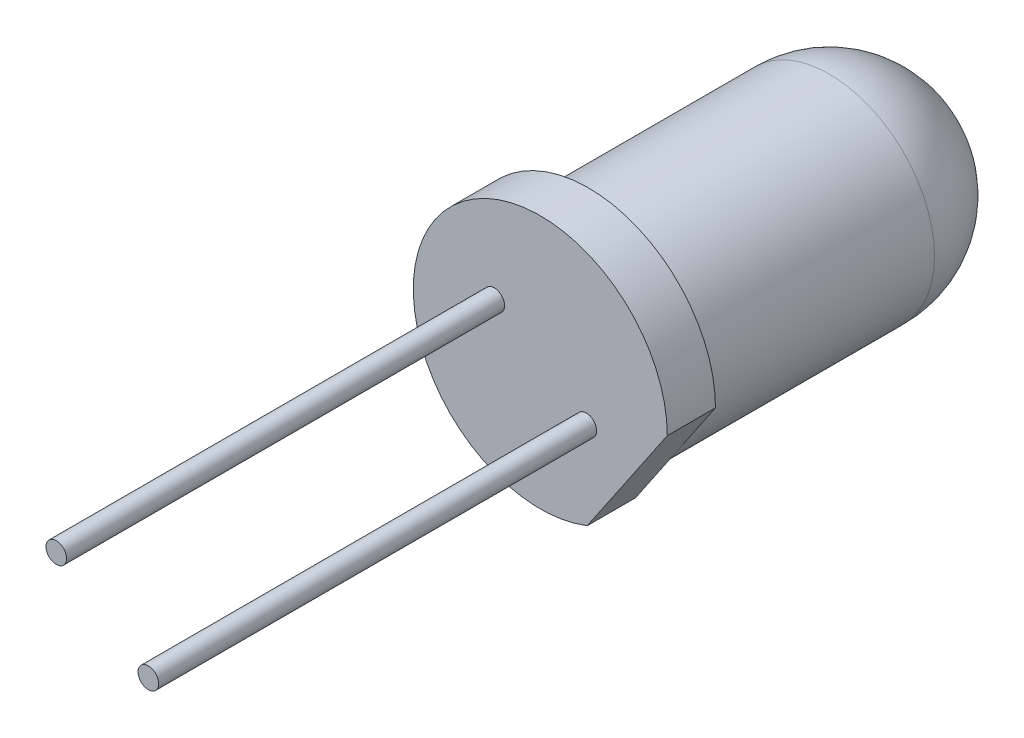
SolidWorks part; units mm, degrees
ref_plane "Plan1" through (0, 0, 0) normal (0, 0, 1) x (1, 0, 0)
ref_plane "Plan2" through (0, 0, 0) normal (0, 1, 0) x (1, 0, 0)
ref_plane "Plan3" through (0, 0, 0) normal (1, 0, 0) x (0, 0, -1)
sketch "Esquisse1" plane through (0, 0, 0) normal (0, 0, 1) x (1, 0, 0)
  circle A0 centre (10, 10) radius 2.9
  dimension "D1" = 5.8
extrude "Base-Extrusion" add sketch "Esquisse1" along normal blind 1.1
sketch "Esquisse2" plane through (0, 0, 0) normal (0, 0, -1) x (-1, 0, 0)
  circle A0 centre (-10, 10) radius 2.4
  dimension "D1" = 4.8
extrude "Boss.-Extru.1" add sketch "Esquisse2" along normal blind 7.9
fillet "Congé1" radius 2.4
sketch "Esquisse3" plane through (0, 0, 0) normal (0, 0, -1) x (-1, 0, 0)
  line L0 (-12.9, 10) -> (-11.0724, 7.3056)
  circle A0 centre (-10, 10) radius 2.9 construction
  circle A1 centre (-10, 10) radius 2.4 construction
extrude "Enlèv. mat.-Extru.1" cut sketch "Esquisse3" against normal through all flip side to cut
sketch "Esquisse4" plane through (0, 0, 1.1) normal (0, 0, 1) x (1, 0, 0)
  line L0 (12.9, 10) -> (11.0724, 7.3056) construction
  circle A0 centre (8.949, 10.7129) radius 0.2353
  circle A1 centre (11.051, 9.2871) radius 0.2353
  dimension "D1" = 2.54
  dimension "D2" = 1.27
extrude "Boss.-Extru.2" add sketch "Esquisse4" along normal blind 10
equation "\"D1@Esquisse4\"=\"D2@Esquisse4\"*2"
